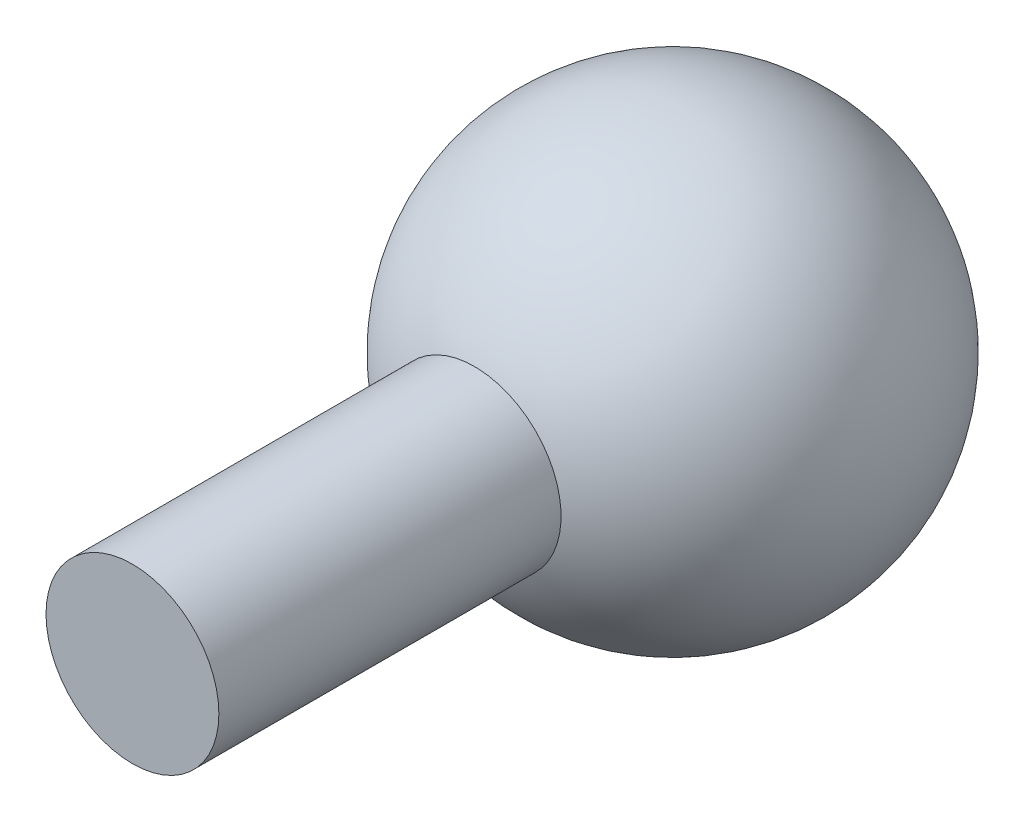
SolidWorks part; units mm, degrees
ref_plane "Plan de face" through (0, 0, 0) normal (0, 0, 1) x (1, 0, 0)
ref_plane "Plan de dessus" through (0, 0, 0) normal (0, 1, 0) x (1, 0, 0)
ref_plane "Plan de droite" through (0, 0, 0) normal (1, 0, 0) x (0, 0, -1)
sketch "Esquisse1" plane through (0, 0, 0) normal (0, 0, 1) x (1, 0, 0)
  line L0 (0, 19.3822) -> (0, -25.5435) construction
  line L1 (0, 10) -> (0, -10)
  arc A0 (0, 10) -> (0, -10) centre (0, 0) ccw
  dimension "D1" = 20
revolve "Révolution2" add sketch "Esquisse1" angle 360 about L0
sketch "Esquisse2" plane through (0, 0, 0) normal (0, 0, 1) x (1, 0, 0)
  circle A0 centre (0, 0) radius 4
  dimension "D1" = 8
extrude "Extrusion1" add sketch "Esquisse2" along normal blind 25
